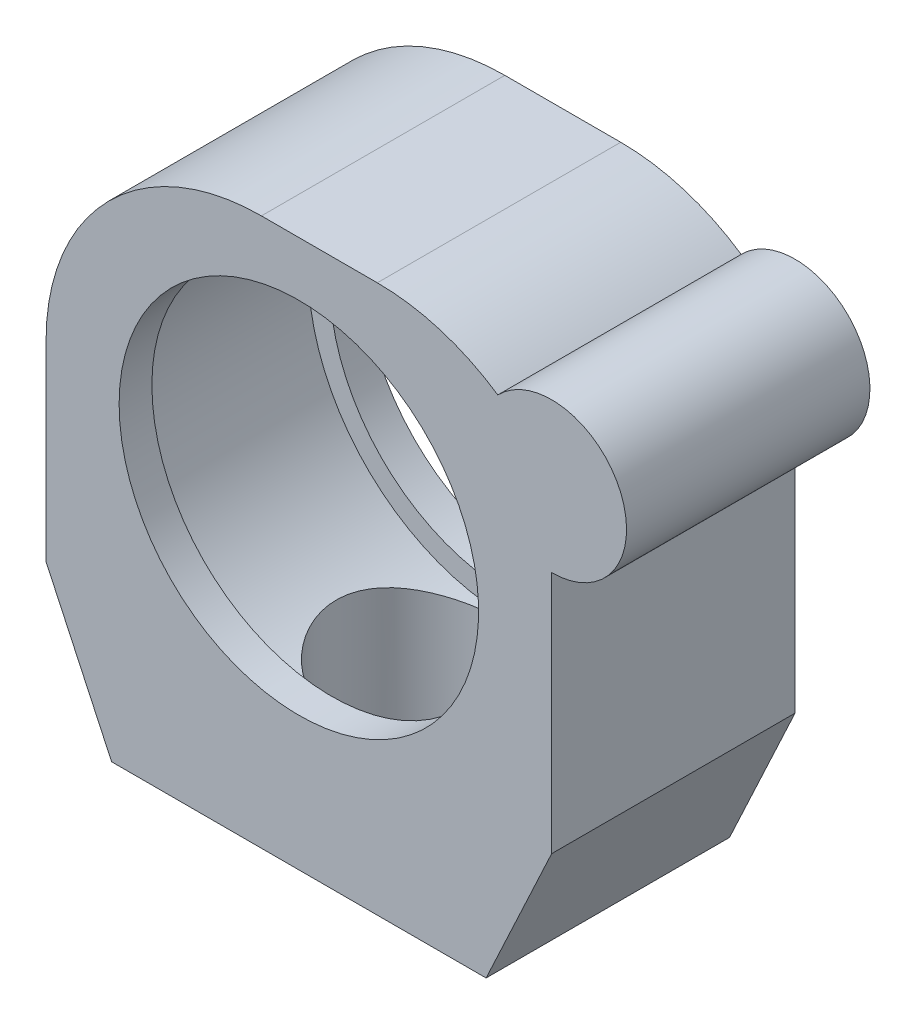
SolidWorks part; units mm, degrees
ref_plane "Front Plane" through (0, 0, 0) normal (0, 0, 1) x (1, 0, 0)
ref_plane "Top Plane" through (0, 0, 0) normal (0, 1, 0) x (1, 0, 0)
ref_plane "Right Plane" through (0, 0, 0) normal (1, 0, 0) x (0, 0, -1)
sketch "Sketch1" plane through (0, 0, 0) normal (0, 0, -1) x (-1, 0, 0)
  line L7 (-27, 7.5) -> (-27, -18.5)
  line L8 (-27, -18.5) -> (-20, -33.5)
  line L9 (-20, -33.5) -> (20, -33.5)
  line L10 (20, -33.5) -> (27, -18.5)
  line L11 (27, -18.5) -> (27, -15.5)
  line L12 (27, 2) -> (27, -15.5)
  line L13 (4, 25) -> (-8.3788, 25)
  arc A5 (-16.6513, 9.5591) -> (16.6513, -9.5591) centre (0, 0) ccw
  arc A6 (16.6513, -9.5591) -> (-16.6513, 9.5591) centre (0, 0) ccw
  arc A7 (-21.2495, 21.0616) -> (-27, 7.5) centre (-27, 15.5) ccw
  arc A8 (27, 2) -> (4, 25) centre (4, 2) ccw
  arc A9 (-8.3788, 25) -> (-21.2495, 21.0616) centre (-8.3788, 2) ccw
extrude "Boss-Extrude1" add sketch "Sketch1" against normal mid plane 26
sketch "Sketch2" plane through (0, 0, 0) normal (0, 0, 1) x (1, 0, 0)
  circle A0 centre (0, 0) radius 21.5
  dimension "D1" = 43
extrude "Cut-Extrude1" cut sketch "Sketch2" against normal blind 9.5 and the other way blind 9.5
sketch "Sketch3" plane through (0, -33.5, 0) normal (0, -1, 0) x (1, 0, 0)
  line L0 (-852.8516, 0) -> (49147.1484, 0) construction
  line L1 (20, 13) -> (20, -13) construction
  line L2 (0, -1013) -> (0, 48987) construction
  line L3 (20, -13) -> (-20, -13) construction
  circle A0 centre (0, 0) radius 9
  point P7 (20, 0)
  point P12 (0, -13)
  dimension "D1" = 18
extrude "Cut-Extrude2" cut sketch "Sketch3" against normal up to next
hole_wizard "Ø6.0 (6) Diameter Hole1" positions "Sketch6" profile "Sketch5" hole size "Ø6.0" standard "ANSI Metric"
sketch "Sketch6" plane through (0, -33.5, 0) normal (0, -1, 0) x (-1, 0, 0)
  line L0 (-1147.1484, 0) -> (48852.8516, 0) construction
  line L1 (-20, -13) -> (-20, 13) construction
  line L2 (0, -1013) -> (0, 48987) construction
  line L3 (-20, -13) -> (20, -13) construction
  point P0 (-15, 0)
  point P2 (15, 0)
  point P10 (-20, 0)
  point P17 (0, -13)
  dimension "D1" = 30
sketch "Sketch5" plane through (15, -33.5, 0) normal (1, 0, 0) x (0, 0, -1)
  line L0 (0, 0) -> (0, 11.8026)
  line L1 (0, 11.8026) -> (3, 10)
  line L2 (3, 10) -> (3, 0)
  line L5 (3, 0) -> (0, 0)
  line L10 (0, 11.8026) -> (-3, 10) construction
  line L11 (0, -6.35) -> (0, 107.95) construction
  dimension "Hole Dia." = 6
  dimension "Hole Depth" = 10
  dimension "Drill Angle" = 118
sketch "Sketch7" plane through (0, 0, -13) normal (0, 0, -1) x (-1, 0, 0)
  point P0 (0, 0)
sketch "Sketch8" plane through (0, 0, 13) normal (0, 0, 1) x (1, 0, 0)
  point P0 (0, 0)
